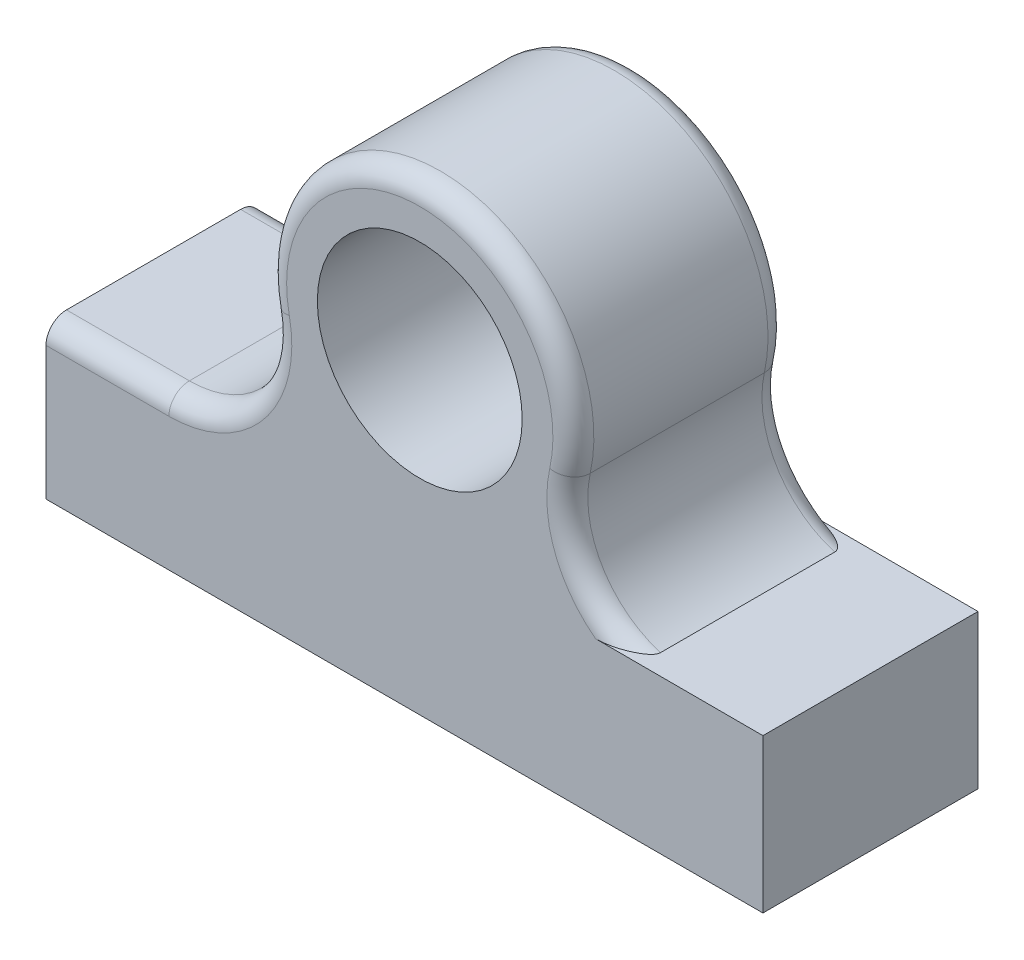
SolidWorks part; units mm, degrees
ref_plane "Alzado" through (0, 0, 0) normal (0, 0, 1) x (1, 0, 0)
ref_plane "Planta" through (0, 0, 0) normal (0, 1, 0) x (1, 0, 0)
ref_plane "Vista lateral" through (0, 0, 0) normal (1, 0, 0) x (0, 0, -1)
sketch "Croquis1" plane through (0, 0, 0) normal (0, 0, 1) x (1, 0, 0)
  line L0 (33.5051, 3.9977) -> (-36.4949, 3.9977)
  line L1 (-36.4949, 3.9977) -> (-36.4949, 18.9977)
  line L2 (-36.4949, 18.9977) -> (-24.4949, 18.9977)
  line L5 (33.5051, 18.9977) -> (21.5051, 19.0153)
  line L6 (33.5051, 3.9977) -> (33.5051, 18.9977)
  arc A0 (14.6442, 30.7501) -> (-14.6969, 30.9977) centre (0, 33.9977) ccw
  arc A1 (-24.4949, 18.9977) -> (-14.6969, 30.9977) centre (-24.4949, 28.9977) ccw
  arc A2 (21.5051, 19.0153) -> (14.6442, 30.7501) centre (24.407, 28.585) cw
  circle A3 centre (0, 33.9977) radius 10
  dimension "D1" = 20
  dimension "D2" = 15
  dimension "D3" = 10
  dimension "D4" = 10
  dimension "D5" = 70
  dimension "D6" = 15
  dimension "D7" = 15
  dimension "D8" = 12
  dimension "D9" = 12
extrude "Extruir1" add sketch "Croquis1" along normal blind 21
fillet "Redondeo1" radius 2 8 edges at (15.7742, 23.5377, 0) (-30.4949, 18.9977, 0) (-16.7489, 22.6732, 0) (15.7742, 23.5377, 21) (-30.4949, 18.9977, 21) (-16.7489, 22.6732, 21) (0.1266, 48.9972, 0) (0.1266, 48.9972, 21)
